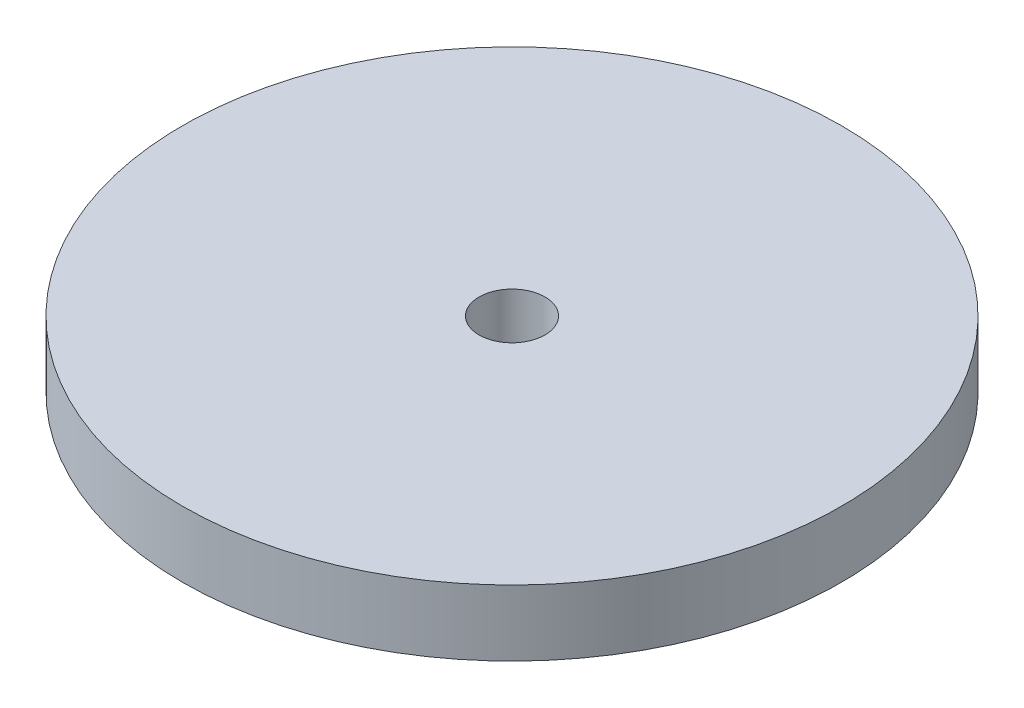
SolidWorks part; units mm, degrees
ref_plane "Front Plane" through (0, 0, 0) normal (0, 0, 1) x (1, 0, 0)
ref_plane "Top Plane" through (0, 0, 0) normal (0, 1, 0) x (1, 0, 0)
ref_plane "Right Plane" through (0, 0, 0) normal (1, 0, 0) x (0, 0, -1)
sketch "Sketch1" plane through (0, 0, 0) normal (0, 1, 0) x (1, 0, 0)
  circle A0 centre (-8.47, 3.2577) radius 31.75
  circle A1 centre (-8.47, 3.2577) radius 3.175
  dimension "D1" = 63.5
  dimension "D2" = 6.35
extrude "Extrude1" add sketch "Sketch1" along normal blind 6.35
